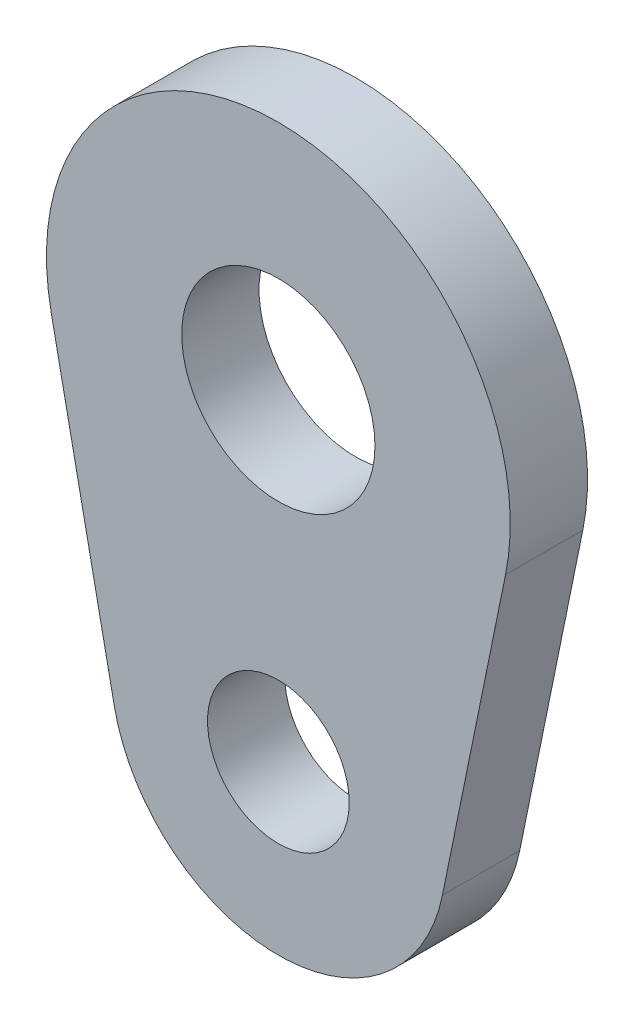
SolidWorks part; units mm, degrees
ref_plane "Face" through (0, 0, 0) normal (0, 0, 1) x (1, 0, 0)
ref_plane "Dessus" through (0, 0, 0) normal (0, 1, 0) x (1, 0, 0)
ref_plane "Droite" through (0, 0, 0) normal (1, 0, 0) x (0, 0, -1)
sketch "Esquisse1" plane through (0, 0, 0) normal (0, 0, 1) x (1, 0, 0)
  line L0 (0, -25) -> (0, 0) construction
  line L1 (-17.6363, -3.6) -> (-12.7373, -27.6)
  line L2 (17.6363, -3.6) -> (12.7373, -27.6)
  circle A0 centre (0, 0) radius 7.5
  circle A1 centre (0, -25) radius 5.5
  arc A2 (17.6363, -3.6) -> (-17.6363, -3.6) centre (0, 0) ccw
  arc A3 (12.7373, -27.6) -> (-12.7373, -27.6) centre (0, -25) cw
  dimension "D2" = 15
  dimension "D3" = 18
  dimension "D4" = 13
  dimension "D5" = 11
  dimension "D1" = 25
extrude "Extrusion1" add sketch "Esquisse1" along normal blind 6
